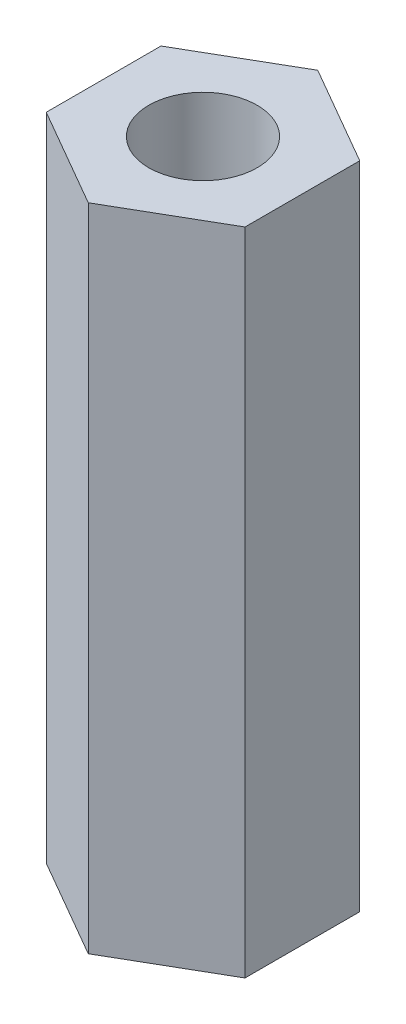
SolidWorks part; units mm, degrees
ref_plane "Front Plane" through (0, 0, 0) normal (0, 0, 1) x (1, 0, 0)
ref_plane "Top Plane" through (0, 0, 0) normal (0, 1, 0) x (1, 0, 0)
ref_plane "Right Plane" through (0, 0, 0) normal (1, 0, 0) x (0, 0, -1)
sketch "Sketch1" plane through (0, 0, 0) normal (0, 1, 0) x (1, 0, 0)
  line L1 (2.75, 1.5877) -> (0, 3.1754)
  line L2 (0, 3.1754) -> (-2.75, 1.5877)
  line L3 (-2.75, 1.5877) -> (-2.75, -1.5877)
  line L4 (-2.75, -1.5877) -> (0, -3.1754)
  line L5 (0, -3.1754) -> (2.75, -1.5877)
  line L6 (2.75, -1.5877) -> (2.75, 1.5877)
  circle A0 centre (0, 0) radius 1.5
  circle A2 centre (0, 0) radius 2.75 construction
  dimension "D1" = 3
  dimension "D3" = 5.5
extrude "Boss-Extrude1" add sketch "Sketch1" along normal blind 18
